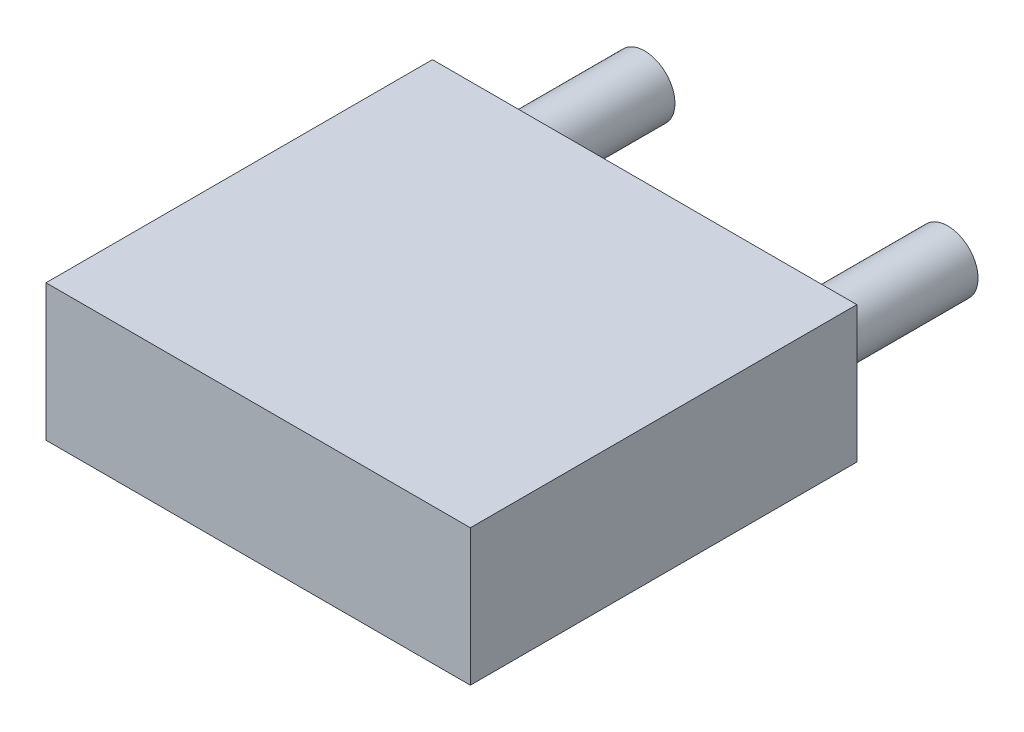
SolidWorks part; units mm, degrees
ref_plane "Front Plane" through (0, 0, 0) normal (0, 0, 1) x (1, 0, 0)
ref_plane "Top Plane" through (0, 0, 0) normal (0, 1, 0) x (1, 0, 0)
ref_plane "Right Plane" through (0, 0, 0) normal (1, 0, 0) x (0, 0, -1)
sketch "Sketch1" plane through (0, 0, 0) normal (0, 0, 1) x (1, 0, 0)
  line L1 (-3.556, 1.143) -> (3.556, 1.143)
  line L2 (-3.556, 1.143) -> (-3.556, -1.143)
  line L3 (-3.556, -1.143) -> (3.556, -1.143)
  line L4 (3.556, 1.143) -> (3.556, -1.143)
extrude "Boss-Extrude1" add sketch "Sketch1" along normal blind 6.477
sketch "Sketch2" plane through (0, 0, 0) normal (0, 0, -1) x (-1, 0, 0)
  circle A0 centre (2.54, 0) radius 0.508
  circle A1 centre (-2.54, 0) radius 0.508
extrude "Boss-Extrude2" add sketch "Sketch2" along normal blind 2.54 separate body
